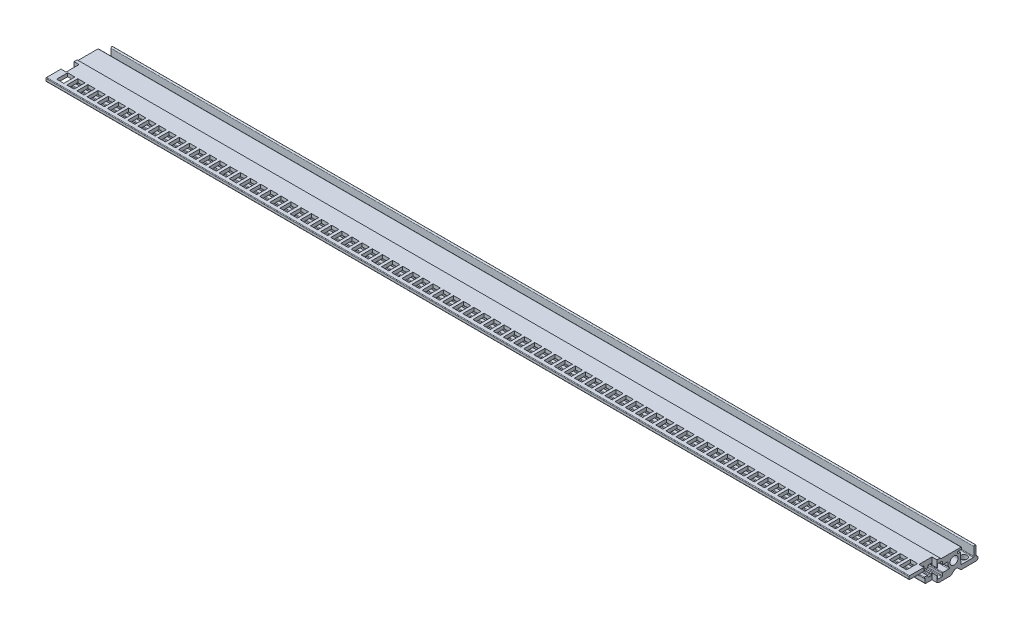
SolidWorks part; units mm, degrees
ref_plane "前视基准面" through (0, 0, 0) normal (0, 0, 1) x (1, 0, 0)
ref_plane "上视基准面" through (0, 0, 0) normal (0, 1, 0) x (1, 0, 0)
ref_plane "右视基准面" through (0, 0, 0) normal (1, 0, 0) x (0, 0, -1)
sketch "草图1" plane through (0, 0, 0) normal (1, 0, 0) x (0, 0, -1)
  line L901 (2.0061, 2.1458) -> (2.0561, 2.1458)
  line L902 (2.2561, 1.9458) -> (2.2561, -0.0542)
  line L903 (2.5561, -0.3542) -> (6.0561, -0.3542)
  line L904 (6.546, -0.7542) -> (12.6401, -0.7542)
  line L905 (12.8419, -0.6762) -> (14.6823, 0.9969)
  line L906 (15.8298, 0.9969) -> (17.6702, -0.6762)
  line L907 (17.872, -0.7542) -> (25.1561, -0.7542)
  line L908 (25.2561, 1.6874) -> (25.2561, 6.0458)
  line L909 (24.2561, 6.0458) -> (24.2561, 1.7458)
  line L910 (23.9561, 1.4458) -> (18.0561, 1.4458)
  line L911 (17.7561, 1.7458) -> (17.7561, 3.0993)
  line L912 (17.5561, 3.4458) -> (17.5561, 6.7458)
  line L913 (17.2561, 7.0458) -> (16.3561, 7.0458)
  line L914 (16.0561, 7.3458) -> (16.0561, 7.7458)
  line L915 (16.3561, 8.0458) -> (17.7561, 8.0458)
  line L916 (18.0561, 8.3458) -> (18.0561, 8.7458)
  line L917 (17.7561, 9.0458) -> (-7.9439, 9.0458)
  line L918 (-8.2439, 8.7458) -> (-8.2439, 8.1458)
  line L919 (-7.9439, 7.8458) -> (1.4561, 7.8458)
  line L920 (1.7561, 7.5458) -> (1.7561, 6.3458)
  line L921 (2.0561, 6.0458) -> (3.4561, 6.0458)
  line L922 (3.7561, 6.3458) -> (3.7561, 6.7458)
  line L923 (4.0561, 7.0458) -> (5.1561, 7.0458)
  line L924 (5.4561, 6.7458) -> (5.4561, 6.3458)
  line L925 (6.0561, 6.3458) -> (6.0561, 7.4058)
  line L926 (6.3561, 7.7058) -> (8.1561, 7.7058)
  line L927 (8.4561, 7.4058) -> (8.4561, 6.3458)
  line L928 (8.7561, 6.0458) -> (10.98, 6.0458)
  line L929 (11.646, 2.6458) -> (8.7561, 2.6458)
  line L930 (8.4561, 2.3458) -> (8.4561, 1.2858)
  line L931 (8.1561, 0.9858) -> (6.3561, 0.9858)
  line L932 (6.0561, 1.2858) -> (6.0561, 2.3458)
  line L933 (5.4561, 2.3458) -> (5.4561, 1.9458)
  line L934 (5.1561, 1.6458) -> (4.0561, 1.6458)
  line L935 (3.7561, 1.9458) -> (3.7561, 2.3458)
  line L936 (3.4561, 2.6458) -> (2.0061, 2.6458)
  circle A0 centre (14.2561, 5.0458) radius 2
  arc A133 (2.0061, 2.6458) -> (2.0061, 2.1458) centre (2.0061, 2.3958) ccw
  arc A134 (2.2561, 1.9458) -> (2.0561, 2.1458) centre (2.0561, 1.9458) ccw
  arc A135 (2.2561, -0.0542) -> (2.5561, -0.3542) centre (2.5561, -0.0542) ccw
  arc A136 (6.35, -0.5942) -> (6.0561, -0.3542) centre (6.0561, -0.6542) ccw
  arc A137 (6.35, -0.5942) -> (6.546, -0.7542) centre (6.546, -0.5542) ccw
  arc A138 (12.6401, -0.7542) -> (12.8419, -0.6762) centre (12.6401, -0.4542) ccw
  arc A139 (15.0701, 1.0103) -> (14.6823, 0.9969) centre (14.8841, 0.7749) ccw
  arc A140 (15.0701, 1.0103) -> (15.442, 1.0103) centre (15.2561, 1.2458) ccw
  arc A141 (15.8298, 0.9969) -> (15.442, 1.0103) centre (15.628, 0.7749) ccw
  arc A142 (17.6702, -0.6762) -> (17.872, -0.7542) centre (17.872, -0.4542) ccw
  arc A143 (25.1561, -0.7542) -> (25.4703, 1.3999) centre (25.1561, 0.3458) ccw
  arc A144 (25.2561, 1.6874) -> (25.4703, 1.3999) centre (25.5561, 1.6874) ccw
  arc A145 (25.2561, 6.0458) -> (24.2561, 6.0458) centre (24.7561, 6.0458) ccw
  arc A146 (23.9561, 1.4458) -> (24.2561, 1.7458) centre (23.9561, 1.7458) ccw
  arc A147 (17.7561, 1.7458) -> (18.0561, 1.4458) centre (18.0561, 1.7458) ccw
  arc A148 (17.7561, 3.0993) -> (17.6561, 3.2726) centre (17.5561, 3.0993) ccw
  arc A149 (17.5561, 3.4458) -> (17.6561, 3.2726) centre (17.7561, 3.4458) ccw
  arc A150 (17.5561, 6.7458) -> (17.2561, 7.0458) centre (17.2561, 6.7458) ccw
  arc A151 (16.0561, 7.3458) -> (16.3561, 7.0458) centre (16.3561, 7.3458) ccw
  arc A152 (16.3561, 8.0458) -> (16.0561, 7.7458) centre (16.3561, 7.7458) ccw
  arc A153 (17.7561, 8.0458) -> (18.0561, 8.3458) centre (17.7561, 8.3458) ccw
  arc A154 (18.0561, 8.7458) -> (17.7561, 9.0458) centre (17.7561, 8.7458) ccw
  arc A155 (-7.9439, 9.0458) -> (-8.2439, 8.7458) centre (-7.9439, 8.7458) ccw
  arc A156 (-8.2439, 8.1458) -> (-7.9439, 7.8458) centre (-7.9439, 8.1458) ccw
  arc A157 (1.7561, 7.5458) -> (1.4561, 7.8458) centre (1.4561, 7.5458) ccw
  arc A158 (1.7561, 6.3458) -> (2.0561, 6.0458) centre (2.0561, 6.3458) ccw
  arc A159 (3.4561, 6.0458) -> (3.7561, 6.3458) centre (3.4561, 6.3458) ccw
  arc A160 (4.0561, 7.0458) -> (3.7561, 6.7458) centre (4.0561, 6.7458) ccw
  arc A161 (5.4561, 6.7458) -> (5.1561, 7.0458) centre (5.1561, 6.7458) ccw
  arc A162 (5.4561, 6.3458) -> (6.0561, 6.3458) centre (5.7561, 6.3458) ccw
  arc A163 (6.3561, 7.7058) -> (6.0561, 7.4058) centre (6.3561, 7.4058) ccw
  arc A164 (8.4561, 7.4058) -> (8.1561, 7.7058) centre (8.1561, 7.4058) ccw
  arc A165 (8.4561, 6.3458) -> (8.7561, 6.0458) centre (8.7561, 6.3458) ccw
  arc A166 (11.2734, 5.6831) -> (10.98, 6.0458) centre (10.98, 5.7458) ccw
  arc A167 (11.2734, 5.6831) -> (11.8797, 3.1338) centre (14.2561, 5.0458) ccw
  arc A168 (11.646, 2.6458) -> (11.8797, 3.1338) centre (11.646, 2.9458) ccw
  arc A169 (8.7561, 2.6458) -> (8.4561, 2.3458) centre (8.7561, 2.3458) ccw
  arc A170 (8.1561, 0.9858) -> (8.4561, 1.2858) centre (8.1561, 1.2858) ccw
  arc A171 (6.0561, 1.2858) -> (6.3561, 0.9858) centre (6.3561, 1.2858) ccw
  arc A172 (6.0561, 2.3458) -> (5.4561, 2.3458) centre (5.7561, 2.3458) ccw
  arc A173 (5.1561, 1.6458) -> (5.4561, 1.9458) centre (5.1561, 1.9458) ccw
  arc A174 (3.7561, 1.9458) -> (4.0561, 1.6458) centre (4.0561, 1.9458) ccw
  arc A175 (3.7561, 2.3458) -> (3.4561, 2.6458) centre (3.4561, 2.3458) ccw
  dimension "D2" = 0.3
  dimension "D3" = 0.3
  dimension "D6" = 4
  dimension "D1" = 0.6
  dimension "D4" = 25.7
  dimension "D5" = 9.4
extrude "凸台-拉伸1" add sketch "草图1" along normal mid plane 431.8
sketch "草图7" plane through (215.9, 0, 0) normal (1, 0, 0) x (0, 0, -1)
  line L0 (-7.9439, 9.0458) -> (-8.2439, 9.0458)
  line L1 (-8.2439, 9.0458) -> (-8.2439, 8.7458)
  arc A0 (-7.9439, 9.0458) -> (-8.2439, 8.7458) centre (-7.9439, 8.7458) ccw construction
  arc A1 (-7.9439, 9.0458) -> (-8.2439, 8.7458) centre (-7.9439, 8.7458) ccw
extrude "凸台-拉伸4" add sketch "草图7" against normal through all
sketch "草图6" plane through (-215.9, 0, 0) normal (-1, 0, 0) x (0, 0, 1)
  line L0 (-7.8061, 9.0458) -> (8.2439, 9.0458)
  line L1 (-17.7561, 9.0458) -> (8.2439, 9.0458) construction
  line L4 (8.2439, 9.0458) -> (8.2439, 9.5458)
  line L5 (8.2439, 9.5458) -> (-7.3061, 9.5458)
  line L6 (-7.3061, 9.5458) -> (-7.8061, 9.0458)
extrude "凸台-拉伸3" add sketch "草图6" against normal through all
sketch "草图3" plane through (0, 9.5458, 0) normal (0, 1, 0) x (1, 0, 0)
  line L0 (215.9, 17.7561) -> (215.9, 7.8061) construction
  line L1 (215.9, 5.7561) -> (213.36, 5.7561)
  line L2 (215.9, 5.7561) -> (215.9, -0.7439)
  line L3 (215.9, -0.7439) -> (213.36, -0.7439)
  line L4 (213.36, 5.7561) -> (213.36, -0.7439)
  line L5 (215.9, -8.2439) -> (-215.9, -8.2439) construction
  line L7 (0, -8.2439) -> (0, 17.7561) construction
  line L9 (215.9, 17.7561) -> (-215.9, 17.7561) construction
  line L10 (-213.36, 5.7561) -> (-213.36, -0.7439)
  line L11 (-215.9, -0.7439) -> (-213.36, -0.7439)
  line L12 (-215.9, 5.7561) -> (-215.9, -0.7439)
  line L13 (-215.9, 5.7561) -> (-213.36, 5.7561)
  dimension "D1" = 2.54
  dimension "D2" = 7.5
  dimension "D3" = 6.5
extrude "切除-拉伸1" cut sketch "草图3" against normal up to surface (10.3 mm away)
sketch "草图4" plane through (0, -0.7542, 0) normal (0, -1, 0) x (-1, 0, 0)
  line L0 (-213.36, 1.7561) -> (213.36, 1.7561) construction
  line L1 (-215.9, 17.872) -> (-215.9, 25.1561) construction
  circle A0 centre (-213.36, 21.7061) radius 1.65
  circle A1 centre (-208.28, 21.7061) radius 1.65
  circle A2 centre (-203.2, 21.7061) radius 1.65
  circle A3 centre (-198.12, 21.7061) radius 1.65
  circle A4 centre (-193.04, 21.7061) radius 1.65
  circle A5 centre (-187.96, 21.7061) radius 1.65
  circle A6 centre (-182.88, 21.7061) radius 1.65
  circle A7 centre (-177.8, 21.7061) radius 1.65
  circle A8 centre (-172.72, 21.7061) radius 1.65
  circle A9 centre (-167.64, 21.7061) radius 1.65
  circle A10 centre (-162.56, 21.7061) radius 1.65
  circle A11 centre (-157.48, 21.7061) radius 1.65
  circle A12 centre (-152.4, 21.7061) radius 1.65
  circle A13 centre (-147.32, 21.7061) radius 1.65
  circle A14 centre (-142.24, 21.7061) radius 1.65
  circle A15 centre (-137.16, 21.7061) radius 1.65
  circle A16 centre (-132.08, 21.7061) radius 1.65
  circle A17 centre (-127, 21.7061) radius 1.65
  circle A18 centre (-121.92, 21.7061) radius 1.65
  circle A19 centre (-116.84, 21.7061) radius 1.65
  circle A20 centre (-111.76, 21.7061) radius 1.65
  circle A21 centre (-106.68, 21.7061) radius 1.65
  circle A22 centre (-101.6, 21.7061) radius 1.65
  circle A23 centre (-96.52, 21.7061) radius 1.65
  circle A24 centre (-91.44, 21.7061) radius 1.65
  circle A25 centre (-86.36, 21.7061) radius 1.65
  circle A26 centre (-81.28, 21.7061) radius 1.65
  circle A27 centre (-76.2, 21.7061) radius 1.65
  circle A28 centre (-71.12, 21.7061) radius 1.65
  circle A29 centre (-66.04, 21.7061) radius 1.65
  circle A30 centre (-60.96, 21.7061) radius 1.65
  circle A31 centre (-55.88, 21.7061) radius 1.65
  circle A32 centre (-50.8, 21.7061) radius 1.65
  circle A33 centre (-45.72, 21.7061) radius 1.65
  circle A34 centre (-40.64, 21.7061) radius 1.65
  circle A35 centre (-35.56, 21.7061) radius 1.65
  circle A36 centre (-30.48, 21.7061) radius 1.65
  circle A37 centre (-25.4, 21.7061) radius 1.65
  circle A38 centre (-20.32, 21.7061) radius 1.65
  circle A39 centre (-15.24, 21.7061) radius 1.65
  circle A40 centre (-10.16, 21.7061) radius 1.65
  circle A41 centre (-5.08, 21.7061) radius 1.65
  circle A42 centre (0, 21.7061) radius 1.65
  circle A43 centre (5.08, 21.7061) radius 1.65
  circle A44 centre (10.16, 21.7061) radius 1.65
  circle A45 centre (15.24, 21.7061) radius 1.65
  circle A46 centre (20.32, 21.7061) radius 1.65
  circle A47 centre (25.4, 21.7061) radius 1.65
  circle A48 centre (30.48, 21.7061) radius 1.65
  circle A49 centre (35.56, 21.7061) radius 1.65
  circle A50 centre (40.64, 21.7061) radius 1.65
  circle A51 centre (45.72, 21.7061) radius 1.65
  circle A52 centre (50.8, 21.7061) radius 1.65
  circle A53 centre (55.88, 21.7061) radius 1.65
  circle A54 centre (60.96, 21.7061) radius 1.65
  circle A55 centre (66.04, 21.7061) radius 1.65
  circle A56 centre (71.12, 21.7061) radius 1.65
  circle A57 centre (76.2, 21.7061) radius 1.65
  circle A58 centre (81.28, 21.7061) radius 1.65
  circle A59 centre (86.36, 21.7061) radius 1.65
  circle A60 centre (91.44, 21.7061) radius 1.65
  circle A61 centre (96.52, 21.7061) radius 1.65
  circle A62 centre (101.6, 21.7061) radius 1.65
  circle A63 centre (106.68, 21.7061) radius 1.65
  circle A64 centre (111.76, 21.7061) radius 1.65
  circle A65 centre (116.84, 21.7061) radius 1.65
  circle A66 centre (121.92, 21.7061) radius 1.65
  circle A67 centre (127, 21.7061) radius 1.65
  circle A68 centre (132.08, 21.7061) radius 1.65
  circle A69 centre (137.16, 21.7061) radius 1.65
  circle A70 centre (142.24, 21.7061) radius 1.65
  circle A71 centre (147.32, 21.7061) radius 1.65
  circle A72 centre (152.4, 21.7061) radius 1.65
  circle A73 centre (157.48, 21.7061) radius 1.65
  circle A74 centre (162.56, 21.7061) radius 1.65
  circle A75 centre (167.64, 21.7061) radius 1.65
  circle A76 centre (172.72, 21.7061) radius 1.65
  circle A77 centre (177.8, 21.7061) radius 1.65
  circle A78 centre (182.88, 21.7061) radius 1.65
  circle A79 centre (187.96, 21.7061) radius 1.65
  circle A80 centre (193.04, 21.7061) radius 1.65
  circle A81 centre (198.12, 21.7061) radius 1.65
  circle A82 centre (203.2, 21.7061) radius 1.65
  circle A83 centre (208.28, 21.7061) radius 1.65
  circle A84 centre (213.36, 21.7061) radius 1.65
  dimension "D1" = 19.95
  dimension "D2" = 2.54
  dimension "D3" = 3.3
  dimension "D4" = 85
extrude "切除-拉伸2" cut sketch "草图4" against normal up to surface (9.8 mm away)
sketch "草图5" plane through (0, 9.5458, 0) normal (0, 1, 0) x (1, 0, 0)
  line L0 (-215.9, 17.7561) -> (-215.9, 7.8061) construction
  line L1 (-209.02, -6.1939) -> (-212.62, -6.1939)
  line L2 (-209.02, -6.1939) -> (-209.02, -0.6939)
  line L3 (-209.02, -0.6939) -> (-212.62, -0.6939)
  line L4 (-212.62, -6.1939) -> (-212.62, -0.6939)
  line L5 (-209.02, -6.1939) -> (-212.62, -0.6939) construction
  line L6 (-209.02, -0.6939) -> (-212.62, -6.1939) construction
  line L8 (-203.94, -6.1939) -> (-207.54, -6.1939)
  line L9 (-203.94, -6.1939) -> (-203.94, -0.6939)
  line L10 (-203.94, -0.6939) -> (-207.54, -0.6939)
  line L11 (-207.54, -6.1939) -> (-207.54, -0.6939)
  line L12 (-203.94, -6.1939) -> (-207.54, -0.6939) construction
  line L13 (-203.94, -0.6939) -> (-207.54, -6.1939) construction
  line L14 (-198.86, -6.1939) -> (-202.46, -6.1939)
  line L15 (-198.86, -6.1939) -> (-198.86, -0.6939)
  line L16 (-198.86, -0.6939) -> (-202.46, -0.6939)
  line L17 (-202.46, -6.1939) -> (-202.46, -0.6939)
  line L18 (-198.86, -6.1939) -> (-202.46, -0.6939) construction
  line L19 (-198.86, -0.6939) -> (-202.46, -6.1939) construction
  line L20 (-193.78, -6.1939) -> (-197.38, -6.1939)
  line L21 (-193.78, -6.1939) -> (-193.78, -0.6939)
  line L22 (-193.78, -0.6939) -> (-197.38, -0.6939)
  line L23 (-197.38, -6.1939) -> (-197.38, -0.6939)
  line L24 (-193.78, -6.1939) -> (-197.38, -0.6939) construction
  line L25 (-193.78, -0.6939) -> (-197.38, -6.1939) construction
  line L26 (-188.7, -6.1939) -> (-192.3, -6.1939)
  line L27 (-188.7, -6.1939) -> (-188.7, -0.6939)
  line L28 (-188.7, -0.6939) -> (-192.3, -0.6939)
  line L29 (-192.3, -6.1939) -> (-192.3, -0.6939)
  line L30 (-188.7, -6.1939) -> (-192.3, -0.6939) construction
  line L31 (-188.7, -0.6939) -> (-192.3, -6.1939) construction
  line L32 (-183.62, -6.1939) -> (-187.22, -6.1939)
  line L33 (-183.62, -6.1939) -> (-183.62, -0.6939)
  line L34 (-183.62, -0.6939) -> (-187.22, -0.6939)
  line L35 (-187.22, -6.1939) -> (-187.22, -0.6939)
  line L36 (-183.62, -6.1939) -> (-187.22, -0.6939) construction
  line L37 (-183.62, -0.6939) -> (-187.22, -6.1939) construction
  line L38 (-178.54, -6.1939) -> (-182.14, -6.1939)
  line L39 (-178.54, -6.1939) -> (-178.54, -0.6939)
  line L40 (-178.54, -0.6939) -> (-182.14, -0.6939)
  line L41 (-182.14, -6.1939) -> (-182.14, -0.6939)
  line L42 (-178.54, -6.1939) -> (-182.14, -0.6939) construction
  line L43 (-178.54, -0.6939) -> (-182.14, -6.1939) construction
  line L44 (-173.46, -6.1939) -> (-177.06, -6.1939)
  line L45 (-173.46, -6.1939) -> (-173.46, -0.6939)
  line L46 (-173.46, -0.6939) -> (-177.06, -0.6939)
  line L47 (-177.06, -6.1939) -> (-177.06, -0.6939)
  line L48 (-173.46, -6.1939) -> (-177.06, -0.6939) construction
  line L49 (-173.46, -0.6939) -> (-177.06, -6.1939) construction
  line L50 (-168.38, -6.1939) -> (-171.98, -6.1939)
  line L51 (-168.38, -6.1939) -> (-168.38, -0.6939)
  line L52 (-168.38, -0.6939) -> (-171.98, -0.6939)
  line L53 (-171.98, -6.1939) -> (-171.98, -0.6939)
  line L54 (-168.38, -6.1939) -> (-171.98, -0.6939) construction
  line L55 (-168.38, -0.6939) -> (-171.98, -6.1939) construction
  line L56 (-163.3, -6.1939) -> (-166.9, -6.1939)
  line L57 (-163.3, -6.1939) -> (-163.3, -0.6939)
  line L58 (-163.3, -0.6939) -> (-166.9, -0.6939)
  line L59 (-166.9, -6.1939) -> (-166.9, -0.6939)
  line L60 (-163.3, -6.1939) -> (-166.9, -0.6939) construction
  line L61 (-163.3, -0.6939) -> (-166.9, -6.1939) construction
  line L62 (-158.22, -6.1939) -> (-161.82, -6.1939)
  line L63 (-158.22, -6.1939) -> (-158.22, -0.6939)
  line L64 (-158.22, -0.6939) -> (-161.82, -0.6939)
  line L65 (-161.82, -6.1939) -> (-161.82, -0.6939)
  line L66 (-158.22, -6.1939) -> (-161.82, -0.6939) construction
  line L67 (-158.22, -0.6939) -> (-161.82, -6.1939) construction
  line L68 (-153.14, -6.1939) -> (-156.74, -6.1939)
  line L69 (-153.14, -6.1939) -> (-153.14, -0.6939)
  line L70 (-153.14, -0.6939) -> (-156.74, -0.6939)
  line L71 (-156.74, -6.1939) -> (-156.74, -0.6939)
  line L72 (-153.14, -6.1939) -> (-156.74, -0.6939) construction
  line L73 (-153.14, -0.6939) -> (-156.74, -6.1939) construction
  line L74 (-148.06, -6.1939) -> (-151.66, -6.1939)
  line L75 (-148.06, -6.1939) -> (-148.06, -0.6939)
  line L76 (-148.06, -0.6939) -> (-151.66, -0.6939)
  line L77 (-151.66, -6.1939) -> (-151.66, -0.6939)
  line L78 (-148.06, -6.1939) -> (-151.66, -0.6939) construction
  line L79 (-148.06, -0.6939) -> (-151.66, -6.1939) construction
  line L80 (-142.98, -6.1939) -> (-146.58, -6.1939)
  line L81 (-142.98, -6.1939) -> (-142.98, -0.6939)
  line L82 (-142.98, -0.6939) -> (-146.58, -0.6939)
  line L83 (-146.58, -6.1939) -> (-146.58, -0.6939)
  line L84 (-142.98, -6.1939) -> (-146.58, -0.6939) construction
  line L85 (-142.98, -0.6939) -> (-146.58, -6.1939) construction
  line L86 (-137.9, -6.1939) -> (-141.5, -6.1939)
  line L87 (-137.9, -6.1939) -> (-137.9, -0.6939)
  line L88 (-137.9, -0.6939) -> (-141.5, -0.6939)
  line L89 (-141.5, -6.1939) -> (-141.5, -0.6939)
  line L90 (-137.9, -6.1939) -> (-141.5, -0.6939) construction
  line L91 (-137.9, -0.6939) -> (-141.5, -6.1939) construction
  line L92 (-132.82, -6.1939) -> (-136.42, -6.1939)
  line L93 (-132.82, -6.1939) -> (-132.82, -0.6939)
  line L94 (-132.82, -0.6939) -> (-136.42, -0.6939)
  line L95 (-136.42, -6.1939) -> (-136.42, -0.6939)
  line L96 (-132.82, -6.1939) -> (-136.42, -0.6939) construction
  line L97 (-132.82, -0.6939) -> (-136.42, -6.1939) construction
  line L98 (-127.74, -6.1939) -> (-131.34, -6.1939)
  line L99 (-127.74, -6.1939) -> (-127.74, -0.6939)
  line L100 (-127.74, -0.6939) -> (-131.34, -0.6939)
  line L101 (-131.34, -6.1939) -> (-131.34, -0.6939)
  line L102 (-127.74, -6.1939) -> (-131.34, -0.6939) construction
  line L103 (-127.74, -0.6939) -> (-131.34, -6.1939) construction
  line L104 (-122.66, -6.1939) -> (-126.26, -6.1939)
  line L105 (-122.66, -6.1939) -> (-122.66, -0.6939)
  line L106 (-122.66, -0.6939) -> (-126.26, -0.6939)
  line L107 (-126.26, -6.1939) -> (-126.26, -0.6939)
  line L108 (-122.66, -6.1939) -> (-126.26, -0.6939) construction
  line L109 (-122.66, -0.6939) -> (-126.26, -6.1939) construction
  line L110 (-117.58, -6.1939) -> (-121.18, -6.1939)
  line L111 (-117.58, -6.1939) -> (-117.58, -0.6939)
  line L112 (-117.58, -0.6939) -> (-121.18, -0.6939)
  line L113 (-121.18, -6.1939) -> (-121.18, -0.6939)
  line L114 (-117.58, -6.1939) -> (-121.18, -0.6939) construction
  line L115 (-117.58, -0.6939) -> (-121.18, -6.1939) construction
  line L116 (-112.5, -6.1939) -> (-116.1, -6.1939)
  line L117 (-112.5, -6.1939) -> (-112.5, -0.6939)
  line L118 (-112.5, -0.6939) -> (-116.1, -0.6939)
  line L119 (-116.1, -6.1939) -> (-116.1, -0.6939)
  line L120 (-112.5, -6.1939) -> (-116.1, -0.6939) construction
  line L121 (-112.5, -0.6939) -> (-116.1, -6.1939) construction
  line L122 (-107.42, -6.1939) -> (-111.02, -6.1939)
  line L123 (-107.42, -6.1939) -> (-107.42, -0.6939)
  line L124 (-107.42, -0.6939) -> (-111.02, -0.6939)
  line L125 (-111.02, -6.1939) -> (-111.02, -0.6939)
  line L126 (-107.42, -6.1939) -> (-111.02, -0.6939) construction
  line L127 (-107.42, -0.6939) -> (-111.02, -6.1939) construction
  line L128 (-102.34, -6.1939) -> (-105.94, -6.1939)
  line L129 (-102.34, -6.1939) -> (-102.34, -0.6939)
  line L130 (-102.34, -0.6939) -> (-105.94, -0.6939)
  line L131 (-105.94, -6.1939) -> (-105.94, -0.6939)
  line L132 (-102.34, -6.1939) -> (-105.94, -0.6939) construction
  line L133 (-102.34, -0.6939) -> (-105.94, -6.1939) construction
  line L134 (-97.26, -6.1939) -> (-100.86, -6.1939)
  line L135 (-97.26, -6.1939) -> (-97.26, -0.6939)
  line L136 (-97.26, -0.6939) -> (-100.86, -0.6939)
  line L137 (-100.86, -6.1939) -> (-100.86, -0.6939)
  line L138 (-97.26, -6.1939) -> (-100.86, -0.6939) construction
  line L139 (-97.26, -0.6939) -> (-100.86, -6.1939) construction
  line L140 (-92.18, -6.1939) -> (-95.78, -6.1939)
  line L141 (-92.18, -6.1939) -> (-92.18, -0.6939)
  line L142 (-92.18, -0.6939) -> (-95.78, -0.6939)
  line L143 (-95.78, -6.1939) -> (-95.78, -0.6939)
  line L144 (-92.18, -6.1939) -> (-95.78, -0.6939) construction
  line L145 (-92.18, -0.6939) -> (-95.78, -6.1939) construction
  line L146 (-87.1, -6.1939) -> (-90.7, -6.1939)
  line L147 (-87.1, -6.1939) -> (-87.1, -0.6939)
  line L148 (-87.1, -0.6939) -> (-90.7, -0.6939)
  line L149 (-90.7, -6.1939) -> (-90.7, -0.6939)
  line L150 (-87.1, -6.1939) -> (-90.7, -0.6939) construction
  line L151 (-87.1, -0.6939) -> (-90.7, -6.1939) construction
  line L152 (-82.02, -6.1939) -> (-85.62, -6.1939)
  line L153 (-82.02, -6.1939) -> (-82.02, -0.6939)
  line L154 (-82.02, -0.6939) -> (-85.62, -0.6939)
  line L155 (-85.62, -6.1939) -> (-85.62, -0.6939)
  line L156 (-82.02, -6.1939) -> (-85.62, -0.6939) construction
  line L157 (-82.02, -0.6939) -> (-85.62, -6.1939) construction
  line L158 (-76.94, -6.1939) -> (-80.54, -6.1939)
  line L159 (-76.94, -6.1939) -> (-76.94, -0.6939)
  line L160 (-76.94, -0.6939) -> (-80.54, -0.6939)
  line L161 (-80.54, -6.1939) -> (-80.54, -0.6939)
  line L162 (-76.94, -6.1939) -> (-80.54, -0.6939) construction
  line L163 (-76.94, -0.6939) -> (-80.54, -6.1939) construction
  line L164 (-71.86, -6.1939) -> (-75.46, -6.1939)
  line L165 (-71.86, -6.1939) -> (-71.86, -0.6939)
  line L166 (-71.86, -0.6939) -> (-75.46, -0.6939)
  line L167 (-75.46, -6.1939) -> (-75.46, -0.6939)
  line L168 (-71.86, -6.1939) -> (-75.46, -0.6939) construction
  line L169 (-71.86, -0.6939) -> (-75.46, -6.1939) construction
  line L170 (-66.78, -6.1939) -> (-70.38, -6.1939)
  line L171 (-66.78, -6.1939) -> (-66.78, -0.6939)
  line L172 (-66.78, -0.6939) -> (-70.38, -0.6939)
  line L173 (-70.38, -6.1939) -> (-70.38, -0.6939)
  line L174 (-66.78, -6.1939) -> (-70.38, -0.6939) construction
  line L175 (-66.78, -0.6939) -> (-70.38, -6.1939) construction
  line L176 (-61.7, -6.1939) -> (-65.3, -6.1939)
  line L177 (-61.7, -6.1939) -> (-61.7, -0.6939)
  line L178 (-61.7, -0.6939) -> (-65.3, -0.6939)
  line L179 (-65.3, -6.1939) -> (-65.3, -0.6939)
  line L180 (-61.7, -6.1939) -> (-65.3, -0.6939) construction
  line L181 (-61.7, -0.6939) -> (-65.3, -6.1939) construction
  line L182 (-56.62, -6.1939) -> (-60.22, -6.1939)
  line L183 (-56.62, -6.1939) -> (-56.62, -0.6939)
  line L184 (-56.62, -0.6939) -> (-60.22, -0.6939)
  line L185 (-60.22, -6.1939) -> (-60.22, -0.6939)
  line L186 (-56.62, -6.1939) -> (-60.22, -0.6939) construction
  line L187 (-56.62, -0.6939) -> (-60.22, -6.1939) construction
  line L188 (-51.54, -6.1939) -> (-55.14, -6.1939)
  line L189 (-51.54, -6.1939) -> (-51.54, -0.6939)
  line L190 (-51.54, -0.6939) -> (-55.14, -0.6939)
  line L191 (-55.14, -6.1939) -> (-55.14, -0.6939)
  line L192 (-51.54, -6.1939) -> (-55.14, -0.6939) construction
  line L193 (-51.54, -0.6939) -> (-55.14, -6.1939) construction
  line L194 (-46.46, -6.1939) -> (-50.06, -6.1939)
  line L195 (-46.46, -6.1939) -> (-46.46, -0.6939)
  line L196 (-46.46, -0.6939) -> (-50.06, -0.6939)
  line L197 (-50.06, -6.1939) -> (-50.06, -0.6939)
  line L198 (-46.46, -6.1939) -> (-50.06, -0.6939) construction
  line L199 (-46.46, -0.6939) -> (-50.06, -6.1939) construction
  line L200 (-41.38, -6.1939) -> (-44.98, -6.1939)
  line L201 (-41.38, -6.1939) -> (-41.38, -0.6939)
  line L202 (-41.38, -0.6939) -> (-44.98, -0.6939)
  line L203 (-44.98, -6.1939) -> (-44.98, -0.6939)
  line L204 (-41.38, -6.1939) -> (-44.98, -0.6939) construction
  line L205 (-41.38, -0.6939) -> (-44.98, -6.1939) construction
  line L206 (-36.3, -6.1939) -> (-39.9, -6.1939)
  line L207 (-36.3, -6.1939) -> (-36.3, -0.6939)
  line L208 (-36.3, -0.6939) -> (-39.9, -0.6939)
  line L209 (-39.9, -6.1939) -> (-39.9, -0.6939)
  line L210 (-36.3, -6.1939) -> (-39.9, -0.6939) construction
  line L211 (-36.3, -0.6939) -> (-39.9, -6.1939) construction
  line L212 (-31.22, -6.1939) -> (-34.82, -6.1939)
  line L213 (-31.22, -6.1939) -> (-31.22, -0.6939)
  line L214 (-31.22, -0.6939) -> (-34.82, -0.6939)
  line L215 (-34.82, -6.1939) -> (-34.82, -0.6939)
  line L216 (-31.22, -6.1939) -> (-34.82, -0.6939) construction
  line L217 (-31.22, -0.6939) -> (-34.82, -6.1939) construction
  line L218 (-26.14, -6.1939) -> (-29.74, -6.1939)
  line L219 (-26.14, -6.1939) -> (-26.14, -0.6939)
  line L220 (-26.14, -0.6939) -> (-29.74, -0.6939)
  line L221 (-29.74, -6.1939) -> (-29.74, -0.6939)
  line L222 (-26.14, -6.1939) -> (-29.74, -0.6939) construction
  line L223 (-26.14, -0.6939) -> (-29.74, -6.1939) construction
  line L224 (-21.06, -6.1939) -> (-24.66, -6.1939)
  line L225 (-21.06, -6.1939) -> (-21.06, -0.6939)
  line L226 (-21.06, -0.6939) -> (-24.66, -0.6939)
  line L227 (-24.66, -6.1939) -> (-24.66, -0.6939)
  line L228 (-21.06, -6.1939) -> (-24.66, -0.6939) construction
  line L229 (-21.06, -0.6939) -> (-24.66, -6.1939) construction
  line L230 (-15.98, -6.1939) -> (-19.58, -6.1939)
  line L231 (-15.98, -6.1939) -> (-15.98, -0.6939)
  line L232 (-15.98, -0.6939) -> (-19.58, -0.6939)
  line L233 (-19.58, -6.1939) -> (-19.58, -0.6939)
  line L234 (-15.98, -6.1939) -> (-19.58, -0.6939) construction
  line L235 (-15.98, -0.6939) -> (-19.58, -6.1939) construction
  line L236 (-10.9, -6.1939) -> (-14.5, -6.1939)
  line L237 (-10.9, -6.1939) -> (-10.9, -0.6939)
  line L238 (-10.9, -0.6939) -> (-14.5, -0.6939)
  line L239 (-14.5, -6.1939) -> (-14.5, -0.6939)
  line L240 (-10.9, -6.1939) -> (-14.5, -0.6939) construction
  line L241 (-10.9, -0.6939) -> (-14.5, -6.1939) construction
  line L242 (-5.82, -6.1939) -> (-9.42, -6.1939)
  line L243 (-5.82, -6.1939) -> (-5.82, -0.6939)
  line L244 (-5.82, -0.6939) -> (-9.42, -0.6939)
  line L245 (-9.42, -6.1939) -> (-9.42, -0.6939)
  line L246 (-5.82, -6.1939) -> (-9.42, -0.6939) construction
  line L247 (-5.82, -0.6939) -> (-9.42, -6.1939) construction
  line L248 (-0.74, -6.1939) -> (-4.34, -6.1939)
  line L249 (-0.74, -6.1939) -> (-0.74, -0.6939)
  line L250 (-0.74, -0.6939) -> (-4.34, -0.6939)
  line L251 (-4.34, -6.1939) -> (-4.34, -0.6939)
  line L252 (-0.74, -6.1939) -> (-4.34, -0.6939) construction
  line L253 (-0.74, -0.6939) -> (-4.34, -6.1939) construction
  line L254 (4.34, -6.1939) -> (0.74, -6.1939)
  line L255 (4.34, -6.1939) -> (4.34, -0.6939)
  line L256 (4.34, -0.6939) -> (0.74, -0.6939)
  line L257 (0.74, -6.1939) -> (0.74, -0.6939)
  line L258 (4.34, -6.1939) -> (0.74, -0.6939) construction
  line L259 (4.34, -0.6939) -> (0.74, -6.1939) construction
  line L260 (9.42, -6.1939) -> (5.82, -6.1939)
  line L261 (9.42, -6.1939) -> (9.42, -0.6939)
  line L262 (9.42, -0.6939) -> (5.82, -0.6939)
  line L263 (5.82, -6.1939) -> (5.82, -0.6939)
  line L264 (9.42, -6.1939) -> (5.82, -0.6939) construction
  line L265 (9.42, -0.6939) -> (5.82, -6.1939) construction
  line L266 (14.5, -6.1939) -> (10.9, -6.1939)
  line L267 (14.5, -6.1939) -> (14.5, -0.6939)
  line L268 (14.5, -0.6939) -> (10.9, -0.6939)
  line L269 (10.9, -6.1939) -> (10.9, -0.6939)
  line L270 (14.5, -6.1939) -> (10.9, -0.6939) construction
  line L271 (14.5, -0.6939) -> (10.9, -6.1939) construction
  line L272 (19.58, -6.1939) -> (15.98, -6.1939)
  line L273 (19.58, -6.1939) -> (19.58, -0.6939)
  line L274 (19.58, -0.6939) -> (15.98, -0.6939)
  line L275 (15.98, -6.1939) -> (15.98, -0.6939)
  line L276 (19.58, -6.1939) -> (15.98, -0.6939) construction
  line L277 (19.58, -0.6939) -> (15.98, -6.1939) construction
  line L278 (24.66, -6.1939) -> (21.06, -6.1939)
  line L279 (24.66, -6.1939) -> (24.66, -0.6939)
  line L280 (24.66, -0.6939) -> (21.06, -0.6939)
  line L281 (21.06, -6.1939) -> (21.06, -0.6939)
  line L282 (24.66, -6.1939) -> (21.06, -0.6939) construction
  line L283 (24.66, -0.6939) -> (21.06, -6.1939) construction
  line L284 (29.74, -6.1939) -> (26.14, -6.1939)
  line L285 (29.74, -6.1939) -> (29.74, -0.6939)
  line L286 (29.74, -0.6939) -> (26.14, -0.6939)
  line L287 (26.14, -6.1939) -> (26.14, -0.6939)
  line L288 (29.74, -6.1939) -> (26.14, -0.6939) construction
  line L289 (29.74, -0.6939) -> (26.14, -6.1939) construction
  line L290 (34.82, -6.1939) -> (31.22, -6.1939)
  line L291 (34.82, -6.1939) -> (34.82, -0.6939)
  line L292 (34.82, -0.6939) -> (31.22, -0.6939)
  line L293 (31.22, -6.1939) -> (31.22, -0.6939)
  line L294 (34.82, -6.1939) -> (31.22, -0.6939) construction
  line L295 (34.82, -0.6939) -> (31.22, -6.1939) construction
  line L296 (39.9, -6.1939) -> (36.3, -6.1939)
  line L297 (39.9, -6.1939) -> (39.9, -0.6939)
  line L298 (39.9, -0.6939) -> (36.3, -0.6939)
  line L299 (36.3, -6.1939) -> (36.3, -0.6939)
  line L300 (39.9, -6.1939) -> (36.3, -0.6939) construction
  line L301 (39.9, -0.6939) -> (36.3, -6.1939) construction
  line L302 (44.98, -6.1939) -> (41.38, -6.1939)
  line L303 (44.98, -6.1939) -> (44.98, -0.6939)
  line L304 (44.98, -0.6939) -> (41.38, -0.6939)
  line L305 (41.38, -6.1939) -> (41.38, -0.6939)
  line L306 (44.98, -6.1939) -> (41.38, -0.6939) construction
  line L307 (44.98, -0.6939) -> (41.38, -6.1939) construction
  line L308 (50.06, -6.1939) -> (46.46, -6.1939)
  line L309 (50.06, -6.1939) -> (50.06, -0.6939)
  line L310 (50.06, -0.6939) -> (46.46, -0.6939)
  line L311 (46.46, -6.1939) -> (46.46, -0.6939)
  line L312 (50.06, -6.1939) -> (46.46, -0.6939) construction
  line L313 (50.06, -0.6939) -> (46.46, -6.1939) construction
  line L314 (55.14, -6.1939) -> (51.54, -6.1939)
  line L315 (55.14, -6.1939) -> (55.14, -0.6939)
  line L316 (55.14, -0.6939) -> (51.54, -0.6939)
  line L317 (51.54, -6.1939) -> (51.54, -0.6939)
  line L318 (55.14, -6.1939) -> (51.54, -0.6939) construction
  line L319 (55.14, -0.6939) -> (51.54, -6.1939) construction
  line L320 (60.22, -6.1939) -> (56.62, -6.1939)
  line L321 (60.22, -6.1939) -> (60.22, -0.6939)
  line L322 (60.22, -0.6939) -> (56.62, -0.6939)
  line L323 (56.62, -6.1939) -> (56.62, -0.6939)
  line L324 (60.22, -6.1939) -> (56.62, -0.6939) construction
  line L325 (60.22, -0.6939) -> (56.62, -6.1939) construction
  line L326 (65.3, -6.1939) -> (61.7, -6.1939)
  line L327 (65.3, -6.1939) -> (65.3, -0.6939)
  line L328 (65.3, -0.6939) -> (61.7, -0.6939)
  line L329 (61.7, -6.1939) -> (61.7, -0.6939)
  line L330 (65.3, -6.1939) -> (61.7, -0.6939) construction
  line L331 (65.3, -0.6939) -> (61.7, -6.1939) construction
  line L332 (70.38, -6.1939) -> (66.78, -6.1939)
  line L333 (70.38, -6.1939) -> (70.38, -0.6939)
  line L334 (70.38, -0.6939) -> (66.78, -0.6939)
  line L335 (66.78, -6.1939) -> (66.78, -0.6939)
  line L336 (70.38, -6.1939) -> (66.78, -0.6939) construction
  line L337 (70.38, -0.6939) -> (66.78, -6.1939) construction
  line L338 (75.46, -6.1939) -> (71.86, -6.1939)
  line L339 (75.46, -6.1939) -> (75.46, -0.6939)
  line L340 (75.46, -0.6939) -> (71.86, -0.6939)
  line L341 (71.86, -6.1939) -> (71.86, -0.6939)
  line L342 (75.46, -6.1939) -> (71.86, -0.6939) construction
  line L343 (75.46, -0.6939) -> (71.86, -6.1939) construction
  line L344 (80.54, -6.1939) -> (76.94, -6.1939)
  line L345 (80.54, -6.1939) -> (80.54, -0.6939)
  line L346 (80.54, -0.6939) -> (76.94, -0.6939)
  line L347 (76.94, -6.1939) -> (76.94, -0.6939)
  line L348 (80.54, -6.1939) -> (76.94, -0.6939) construction
  line L349 (80.54, -0.6939) -> (76.94, -6.1939) construction
  line L350 (85.62, -6.1939) -> (82.02, -6.1939)
  line L351 (85.62, -6.1939) -> (85.62, -0.6939)
  line L352 (85.62, -0.6939) -> (82.02, -0.6939)
  line L353 (82.02, -6.1939) -> (82.02, -0.6939)
  line L354 (85.62, -6.1939) -> (82.02, -0.6939) construction
  line L355 (85.62, -0.6939) -> (82.02, -6.1939) construction
  line L356 (90.7, -6.1939) -> (87.1, -6.1939)
  line L357 (90.7, -6.1939) -> (90.7, -0.6939)
  line L358 (90.7, -0.6939) -> (87.1, -0.6939)
  line L359 (87.1, -6.1939) -> (87.1, -0.6939)
  line L360 (90.7, -6.1939) -> (87.1, -0.6939) construction
  line L361 (90.7, -0.6939) -> (87.1, -6.1939) construction
  line L362 (95.78, -6.1939) -> (92.18, -6.1939)
  line L363 (95.78, -6.1939) -> (95.78, -0.6939)
  line L364 (95.78, -0.6939) -> (92.18, -0.6939)
  line L365 (92.18, -6.1939) -> (92.18, -0.6939)
  line L366 (95.78, -6.1939) -> (92.18, -0.6939) construction
  line L367 (95.78, -0.6939) -> (92.18, -6.1939) construction
  line L368 (100.86, -6.1939) -> (97.26, -6.1939)
  line L369 (100.86, -6.1939) -> (100.86, -0.6939)
  line L370 (100.86, -0.6939) -> (97.26, -0.6939)
  line L371 (97.26, -6.1939) -> (97.26, -0.6939)
  line L372 (100.86, -6.1939) -> (97.26, -0.6939) construction
  line L373 (100.86, -0.6939) -> (97.26, -6.1939) construction
  line L374 (105.94, -6.1939) -> (102.34, -6.1939)
  line L375 (105.94, -6.1939) -> (105.94, -0.6939)
  line L376 (105.94, -0.6939) -> (102.34, -0.6939)
  line L377 (102.34, -6.1939) -> (102.34, -0.6939)
  line L378 (105.94, -6.1939) -> (102.34, -0.6939) construction
  line L379 (105.94, -0.6939) -> (102.34, -6.1939) construction
  line L380 (111.02, -6.1939) -> (107.42, -6.1939)
  line L381 (111.02, -6.1939) -> (111.02, -0.6939)
  line L382 (111.02, -0.6939) -> (107.42, -0.6939)
  line L383 (107.42, -6.1939) -> (107.42, -0.6939)
  line L384 (111.02, -6.1939) -> (107.42, -0.6939) construction
  line L385 (111.02, -0.6939) -> (107.42, -6.1939) construction
  line L386 (116.1, -6.1939) -> (112.5, -6.1939)
  line L387 (116.1, -6.1939) -> (116.1, -0.6939)
  line L388 (116.1, -0.6939) -> (112.5, -0.6939)
  line L389 (112.5, -6.1939) -> (112.5, -0.6939)
  line L390 (116.1, -6.1939) -> (112.5, -0.6939) construction
  line L391 (116.1, -0.6939) -> (112.5, -6.1939) construction
  line L392 (121.18, -6.1939) -> (117.58, -6.1939)
  line L393 (121.18, -6.1939) -> (121.18, -0.6939)
  line L394 (121.18, -0.6939) -> (117.58, -0.6939)
  line L395 (117.58, -6.1939) -> (117.58, -0.6939)
  line L396 (121.18, -6.1939) -> (117.58, -0.6939) construction
  line L397 (121.18, -0.6939) -> (117.58, -6.1939) construction
  line L398 (126.26, -6.1939) -> (122.66, -6.1939)
  line L399 (126.26, -6.1939) -> (126.26, -0.6939)
  line L400 (126.26, -0.6939) -> (122.66, -0.6939)
  line L401 (122.66, -6.1939) -> (122.66, -0.6939)
  line L402 (126.26, -6.1939) -> (122.66, -0.6939) construction
  line L403 (126.26, -0.6939) -> (122.66, -6.1939) construction
  line L404 (131.34, -6.1939) -> (127.74, -6.1939)
  line L405 (131.34, -6.1939) -> (131.34, -0.6939)
  line L406 (131.34, -0.6939) -> (127.74, -0.6939)
  line L407 (127.74, -6.1939) -> (127.74, -0.6939)
  line L408 (131.34, -6.1939) -> (127.74, -0.6939) construction
  line L409 (131.34, -0.6939) -> (127.74, -6.1939) construction
  line L410 (136.42, -6.1939) -> (132.82, -6.1939)
  line L411 (136.42, -6.1939) -> (136.42, -0.6939)
  line L412 (136.42, -0.6939) -> (132.82, -0.6939)
  line L413 (132.82, -6.1939) -> (132.82, -0.6939)
  line L414 (136.42, -6.1939) -> (132.82, -0.6939) construction
  line L415 (136.42, -0.6939) -> (132.82, -6.1939) construction
  line L416 (141.5, -6.1939) -> (137.9, -6.1939)
  line L417 (141.5, -6.1939) -> (141.5, -0.6939)
  line L418 (141.5, -0.6939) -> (137.9, -0.6939)
  line L419 (137.9, -6.1939) -> (137.9, -0.6939)
  line L420 (141.5, -6.1939) -> (137.9, -0.6939) construction
  line L421 (141.5, -0.6939) -> (137.9, -6.1939) construction
  line L422 (146.58, -6.1939) -> (142.98, -6.1939)
  line L423 (146.58, -6.1939) -> (146.58, -0.6939)
  line L424 (146.58, -0.6939) -> (142.98, -0.6939)
  line L425 (142.98, -6.1939) -> (142.98, -0.6939)
  line L426 (146.58, -6.1939) -> (142.98, -0.6939) construction
  line L427 (146.58, -0.6939) -> (142.98, -6.1939) construction
  line L428 (151.66, -6.1939) -> (148.06, -6.1939)
  line L429 (151.66, -6.1939) -> (151.66, -0.6939)
  line L430 (151.66, -0.6939) -> (148.06, -0.6939)
  line L431 (148.06, -6.1939) -> (148.06, -0.6939)
  line L432 (151.66, -6.1939) -> (148.06, -0.6939) construction
  line L433 (151.66, -0.6939) -> (148.06, -6.1939) construction
  line L434 (156.74, -6.1939) -> (153.14, -6.1939)
  line L435 (156.74, -6.1939) -> (156.74, -0.6939)
  line L436 (156.74, -0.6939) -> (153.14, -0.6939)
  line L437 (153.14, -6.1939) -> (153.14, -0.6939)
  line L438 (156.74, -6.1939) -> (153.14, -0.6939) construction
  line L439 (156.74, -0.6939) -> (153.14, -6.1939) construction
  line L440 (161.82, -6.1939) -> (158.22, -6.1939)
  line L441 (161.82, -6.1939) -> (161.82, -0.6939)
  line L442 (161.82, -0.6939) -> (158.22, -0.6939)
  line L443 (158.22, -6.1939) -> (158.22, -0.6939)
  line L444 (161.82, -6.1939) -> (158.22, -0.6939) construction
  line L445 (161.82, -0.6939) -> (158.22, -6.1939) construction
  line L446 (166.9, -6.1939) -> (163.3, -6.1939)
  line L447 (166.9, -6.1939) -> (166.9, -0.6939)
  line L448 (166.9, -0.6939) -> (163.3, -0.6939)
  line L449 (163.3, -6.1939) -> (163.3, -0.6939)
  line L450 (166.9, -6.1939) -> (163.3, -0.6939) construction
  line L451 (166.9, -0.6939) -> (163.3, -6.1939) construction
  line L452 (171.98, -6.1939) -> (168.38, -6.1939)
  line L453 (171.98, -6.1939) -> (171.98, -0.6939)
  line L454 (171.98, -0.6939) -> (168.38, -0.6939)
  line L455 (168.38, -6.1939) -> (168.38, -0.6939)
  line L456 (171.98, -6.1939) -> (168.38, -0.6939) construction
  line L457 (171.98, -0.6939) -> (168.38, -6.1939) construction
  line L458 (177.06, -6.1939) -> (173.46, -6.1939)
  line L459 (177.06, -6.1939) -> (177.06, -0.6939)
  line L460 (177.06, -0.6939) -> (173.46, -0.6939)
  line L461 (173.46, -6.1939) -> (173.46, -0.6939)
  line L462 (177.06, -6.1939) -> (173.46, -0.6939) construction
  line L463 (177.06, -0.6939) -> (173.46, -6.1939) construction
  line L464 (182.14, -6.1939) -> (178.54, -6.1939)
  line L465 (182.14, -6.1939) -> (182.14, -0.6939)
  line L466 (182.14, -0.6939) -> (178.54, -0.6939)
  line L467 (178.54, -6.1939) -> (178.54, -0.6939)
  line L468 (182.14, -6.1939) -> (178.54, -0.6939) construction
  line L469 (182.14, -0.6939) -> (178.54, -6.1939) construction
  line L470 (187.22, -6.1939) -> (183.62, -6.1939)
  line L471 (187.22, -6.1939) -> (187.22, -0.6939)
  line L472 (187.22, -0.6939) -> (183.62, -0.6939)
  line L473 (183.62, -6.1939) -> (183.62, -0.6939)
  line L474 (187.22, -6.1939) -> (183.62, -0.6939) construction
  line L475 (187.22, -0.6939) -> (183.62, -6.1939) construction
  line L476 (192.3, -6.1939) -> (188.7, -6.1939)
  line L477 (192.3, -6.1939) -> (192.3, -0.6939)
  line L478 (192.3, -0.6939) -> (188.7, -0.6939)
  line L479 (188.7, -6.1939) -> (188.7, -0.6939)
  line L480 (192.3, -6.1939) -> (188.7, -0.6939) construction
  line L481 (192.3, -0.6939) -> (188.7, -6.1939) construction
  line L482 (197.38, -6.1939) -> (193.78, -6.1939)
  line L483 (197.38, -6.1939) -> (197.38, -0.6939)
  line L484 (197.38, -0.6939) -> (193.78, -0.6939)
  line L485 (193.78, -6.1939) -> (193.78, -0.6939)
  line L486 (197.38, -6.1939) -> (193.78, -0.6939) construction
  line L487 (197.38, -0.6939) -> (193.78, -6.1939) construction
  line L488 (202.46, -6.1939) -> (198.86, -6.1939)
  line L489 (202.46, -6.1939) -> (202.46, -0.6939)
  line L490 (202.46, -0.6939) -> (198.86, -0.6939)
  line L491 (198.86, -6.1939) -> (198.86, -0.6939)
  line L492 (202.46, -6.1939) -> (198.86, -0.6939) construction
  line L493 (202.46, -0.6939) -> (198.86, -6.1939) construction
  line L494 (207.54, -6.1939) -> (203.94, -6.1939)
  line L495 (207.54, -6.1939) -> (207.54, -0.6939)
  line L496 (207.54, -0.6939) -> (203.94, -0.6939)
  line L497 (203.94, -6.1939) -> (203.94, -0.6939)
  line L498 (207.54, -6.1939) -> (203.94, -0.6939) construction
  line L499 (207.54, -0.6939) -> (203.94, -6.1939) construction
  line L500 (212.62, -6.1939) -> (209.02, -6.1939)
  line L501 (212.62, -6.1939) -> (212.62, -0.6939)
  line L502 (212.62, -0.6939) -> (209.02, -0.6939)
  line L503 (209.02, -6.1939) -> (209.02, -0.6939)
  line L504 (212.62, -6.1939) -> (209.02, -0.6939) construction
  line L505 (212.62, -0.6939) -> (209.02, -6.1939) construction
  line L506 (215.9, -8.2439) -> (-215.9, -8.2439) construction
  point P0 (-210.82, -3.4439)
  point P10 (-205.74, -3.4439)
  point P15 (-200.66, -3.4439)
  point P20 (-195.58, -3.4439)
  point P25 (-190.5, -3.4439)
  point P30 (-185.42, -3.4439)
  point P35 (-180.34, -3.4439)
  point P40 (-175.26, -3.4439)
  point P45 (-170.18, -3.4439)
  point P50 (-165.1, -3.4439)
  point P55 (-160.02, -3.4439)
  point P60 (-154.94, -3.4439)
  point P65 (-149.86, -3.4439)
  point P70 (-144.78, -3.4439)
  point P75 (-139.7, -3.4439)
  point P80 (-134.62, -3.4439)
  point P85 (-129.54, -3.4439)
  point P90 (-124.46, -3.4439)
  point P95 (-119.38, -3.4439)
  point P100 (-114.3, -3.4439)
  point P105 (-109.22, -3.4439)
  point P110 (-104.14, -3.4439)
  point P115 (-99.06, -3.4439)
  point P120 (-93.98, -3.4439)
  point P125 (-88.9, -3.4439)
  point P130 (-83.82, -3.4439)
  point P135 (-78.74, -3.4439)
  point P140 (-73.66, -3.4439)
  point P145 (-68.58, -3.4439)
  point P150 (-63.5, -3.4439)
  point P155 (-58.42, -3.4439)
  point P160 (-53.34, -3.4439)
  point P165 (-48.26, -3.4439)
  point P170 (-43.18, -3.4439)
  point P175 (-38.1, -3.4439)
  point P180 (-33.02, -3.4439)
  point P185 (-27.94, -3.4439)
  point P190 (-22.86, -3.4439)
  point P195 (-17.78, -3.4439)
  point P200 (-12.7, -3.4439)
  point P205 (-7.62, -3.4439)
  point P210 (-2.54, -3.4439)
  point P215 (2.54, -3.4439)
  point P220 (7.62, -3.4439)
  point P225 (12.7, -3.4439)
  point P230 (17.78, -3.4439)
  point P235 (22.86, -3.4439)
  point P240 (27.94, -3.4439)
  point P245 (33.02, -3.4439)
  point P250 (38.1, -3.4439)
  point P255 (43.18, -3.4439)
  point P260 (48.26, -3.4439)
  point P265 (53.34, -3.4439)
  point P270 (58.42, -3.4439)
  point P275 (63.5, -3.4439)
  point P280 (68.58, -3.4439)
  point P285 (73.66, -3.4439)
  point P290 (78.74, -3.4439)
  point P295 (83.82, -3.4439)
  point P300 (88.9, -3.4439)
  point P305 (93.98, -3.4439)
  point P310 (99.06, -3.4439)
  point P315 (104.14, -3.4439)
  point P320 (109.22, -3.4439)
  point P325 (114.3, -3.4439)
  point P330 (119.38, -3.4439)
  point P335 (124.46, -3.4439)
  point P340 (129.54, -3.4439)
  point P345 (134.62, -3.4439)
  point P350 (139.7, -3.4439)
  point P355 (144.78, -3.4439)
  point P360 (149.86, -3.4439)
  point P365 (154.94, -3.4439)
  point P370 (160.02, -3.4439)
  point P375 (165.1, -3.4439)
  point P380 (170.18, -3.4439)
  point P385 (175.26, -3.4439)
  point P390 (180.34, -3.4439)
  point P395 (185.42, -3.4439)
  point P400 (190.5, -3.4439)
  point P405 (195.58, -3.4439)
  point P410 (200.66, -3.4439)
  point P415 (205.74, -3.4439)
  point P420 (210.82, -3.4439)
  dimension "D1" = 5.08
  dimension "D2" = 4.8
  dimension "D3" = 5.5
  dimension "D4" = 3.6
  dimension "D5" = 84
extrude "切除-拉伸3" cut sketch "草图5" against normal up to surface (9.9 mm away)
fillet "圆角1" radius 0.3 1 edges at (0, 9.5458, 8.2439)
equation "\"D4@草图4\"=\"D1@凸台-拉伸1\"/5.08"
equation "\"D5@草图5\"=\"D1@凸台-拉伸1\"/5.08-1"
